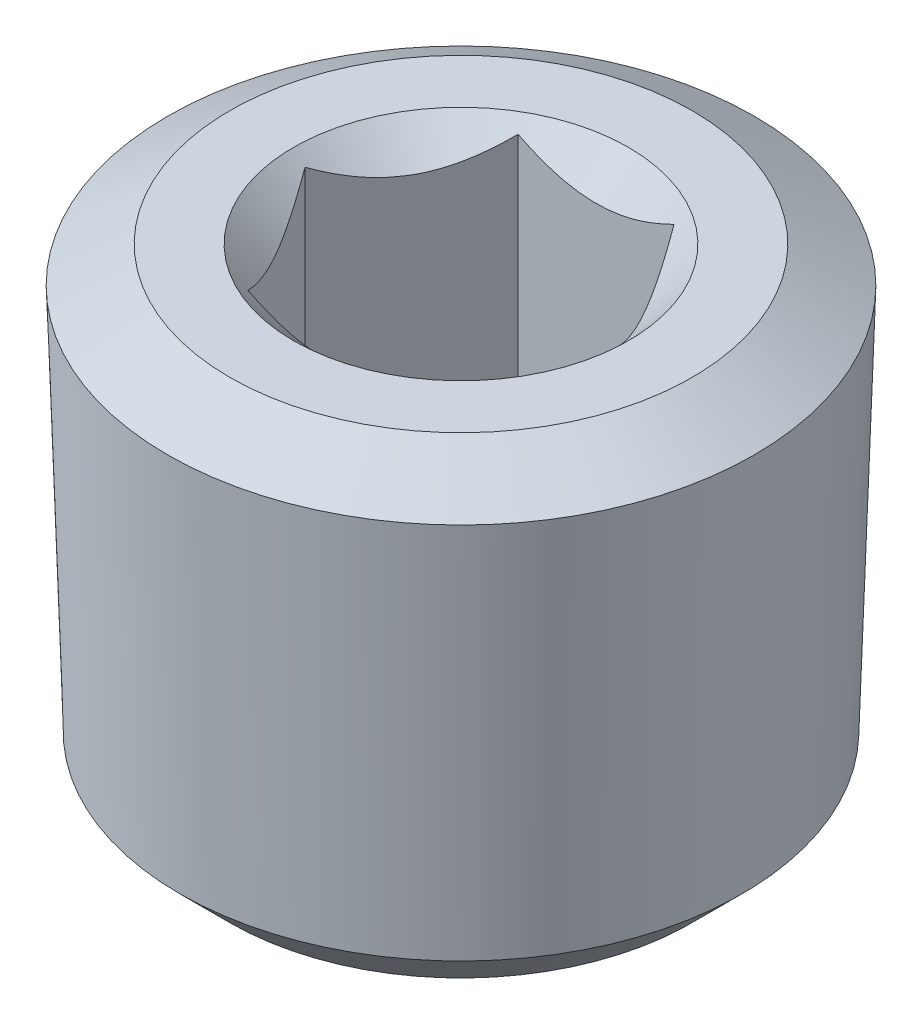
SolidWorks part; units mm, degrees
ref_plane "Front Plane" through (0, 0, 0) normal (0, 0, 1) x (1, 0, 0)
ref_plane "Top Plane" through (0, 0, 0) normal (0, 1, 0) x (1, 0, 0)
ref_plane "Right Plane" through (0, 0, 0) normal (1, 0, 0) x (0, 0, -1)
sketch "Sketch2" plane through (0, 0, 0) normal (0, 0, 1) x (1, 0, 0)
  line L0 (0, 10.7443) -> (0, -17.0657) construction
  line L1 (0, 0) -> (-5.432, 0)
  line L2 (-6.8951, -0.8447) -> (-6.6118, -9.92)
  line L3 (-5.432, -11.0998) -> (0, -11.0998)
  line L4 (0, -11.0998) -> (0, 0)
  line L6 (-5.432, -11.0998) -> (-6.6118, -9.92)
  line L7 (-5.432, 0) -> (-6.8951, -0.8447)
  point P4 (-6.9215, 0)
  point P6 (-6.575, -11.0998)
  dimension "D1" = 11.0998
  dimension "D2" = 1.788
  dimension "D3" = 13.843
  dimension "D4" = 30
  dimension "D5" = 1.143
  dimension "D6" = 45
revolve "Revolve1" add sketch "Sketch2" angle 360 about L0
sketch "Sketch3" plane through (0, 0, 0) normal (0, 0, 1) x (1, 0, 0)
  line L0 (0, 2.9342) -> (0, -8.1202) construction
  line L1 (0, 0) -> (-3.937, 0)
  line L2 (5.432, 0) -> (-5.432, 0) construction
  line L3 (-3.175, -0.762) -> (-3.175, -5.588)
  line L4 (-3.175, -5.588) -> (0, -7.4957)
  line L5 (0, -7.4957) -> (0, 0)
  line L6 (-3.175, -0.762) -> (-3.937, 0)
  dimension "D1" = 5.588
  dimension "D2" = 59
  dimension "D3" = 6.35
  dimension "D4" = 0.762
  dimension "D5" = 45
revolve "Cut-Revolve1" cut sketch "Sketch3" angle 360 about L0
sketch "Sketch4" plane through (0, 0, 0) normal (0, 1, 0) x (1, 0, 0)
  line L1 (-1.8331, -3.175) -> (1.8331, -3.175)
  line L2 (1.8331, -3.175) -> (3.6662, 0)
  line L3 (3.6662, 0) -> (1.8331, 3.175)
  line L4 (1.8331, 3.175) -> (-1.8331, 3.175)
  line L5 (-1.8331, 3.175) -> (-3.6662, 0)
  line L6 (-3.6662, 0) -> (-1.8331, -3.175)
  circle A0 centre (0, 0) radius 3.175 construction
  circle A1 centre (0, 0) radius 3.175 construction
extrude "Cut-Extrude1" cut sketch "Sketch4" against normal up to vertex (5.2929 mm away)
